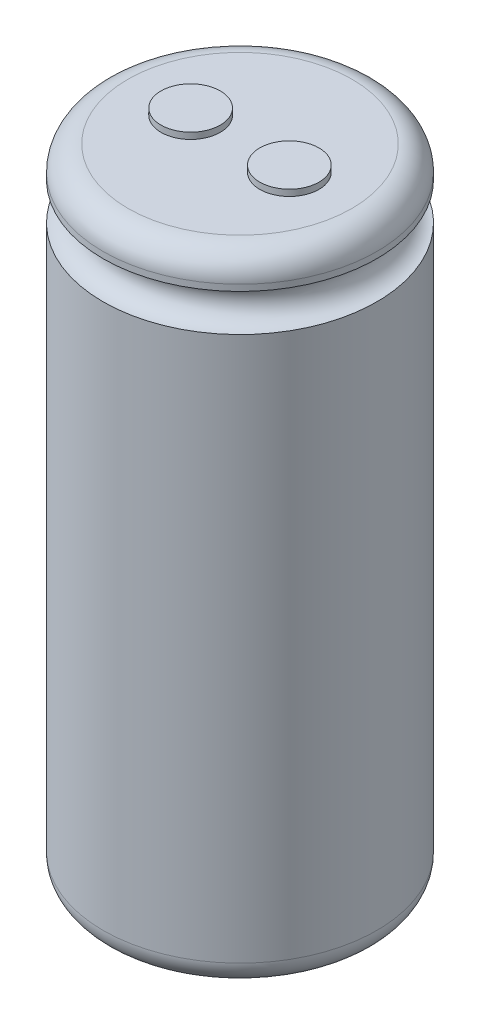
SolidWorks part; units mm, degrees
ref_plane "Front Plane" through (0, 0, 0) normal (0, 0, 1) x (1, 0, 0)
ref_plane "Top Plane" through (0, 0, 0) normal (0, 1, 0) x (1, 0, 0)
ref_plane "Right Plane" through (0, 0, 0) normal (1, 0, 0) x (0, 0, -1)
sketch "Sketch1" plane through (0, 0, 0) normal (1, 0, 0) x (0, 0, -1)
  line L0 (0, 0) -> (9, 0)
  line L1 (11, 49.2572) -> (11, 48.7572)
  line L2 (9, 51.2572) -> (0, 51.2572)
  line L3 (0, 51.2572) -> (0, 0)
  line L4 (11, 45.7572) -> (11, 2)
  arc A0 (11, 48.7572) -> (11, 45.7572) centre (11, 47.2572) ccw
  arc A1 (11, 2) -> (9, 0) centre (9, 2) cw
  arc A2 (9, 51.2572) -> (11, 49.2572) centre (9, 49.2572) cw
  dimension "D1" = 2
  dimension "D3" = 1.5
  dimension "D2" = 51.2572
  dimension "D4" = 4
  dimension "D5" = 11
revolve "Revolve1" add sketch "Sketch1" angle 360 about L3
sketch "Sketch2" plane through (0, 51.2572, 0) normal (0, 1, 0) x (1, 0, 0)
  circle A0 centre (-3.9688, 0) radius 2.3813
  circle A1 centre (3.9688, 0) radius 2.3813
  dimension "D1" = 4.7625
  dimension "D2" = 7.9375
  dimension "D3" = 3.9688
extrude "Boss-Extrude1" add sketch "Sketch2" along normal blind 0.508
